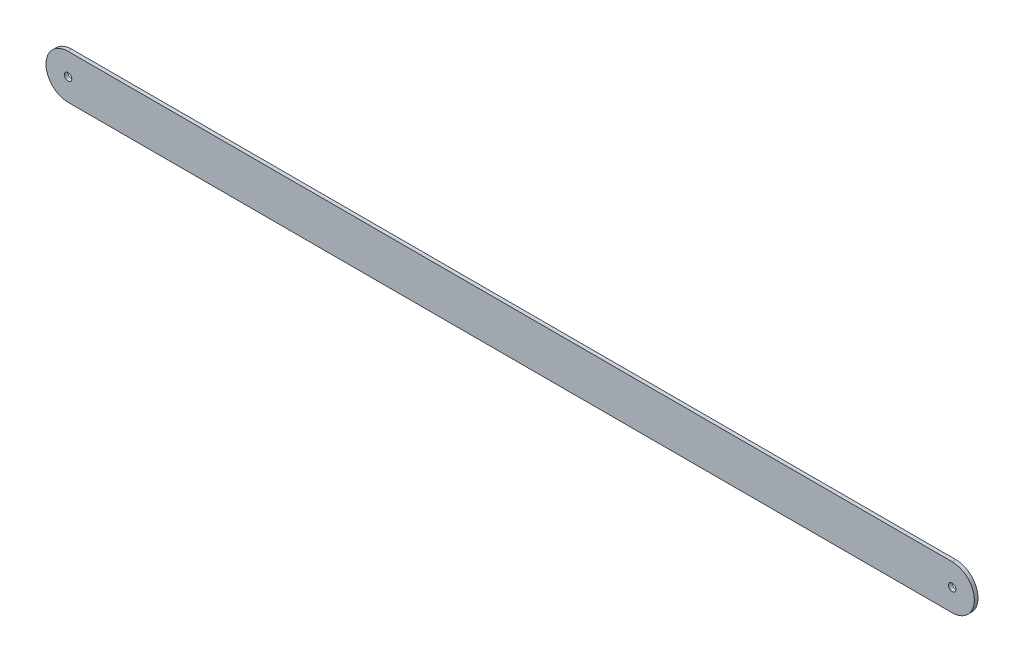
SolidWorks part; units mm, degrees
ref_plane "Front Plane" through (0, 0, 0) normal (0, 0, 1) x (1, 0, 0)
ref_plane "Top Plane" through (0, 0, 0) normal (0, 1, 0) x (1, 0, 0)
ref_plane "Right Plane" through (0, 0, 0) normal (1, 0, 0) x (0, 0, -1)
sketch "Sketch1" plane through (0, 0, 0) normal (0, 0, 1) x (1, 0, 0)
  line L0 (0, 0) -> (240, 0) construction
  line L1 (0.55, 0) -> (-0.55, 0) construction
  line L2 (0, 6) -> (240, 6)
  line L3 (0, -6) -> (240, -6)
  arc A0 (0, 6) -> (0, -6) centre (0, 0) ccw
  arc A1 (240, -6) -> (240, 6) centre (240, 0) ccw
  circle A2 centre (0, 0) radius 1
  circle A4 centre (240, 0) radius 1
  point P5 (120, 0)
  dimension "D2" = 6
  dimension "D3" = 2
  dimension "D5" = 2
  dimension "D1" = 240
extrude "Boss-Extrude1" add sketch "Sketch1" along normal blind 1
